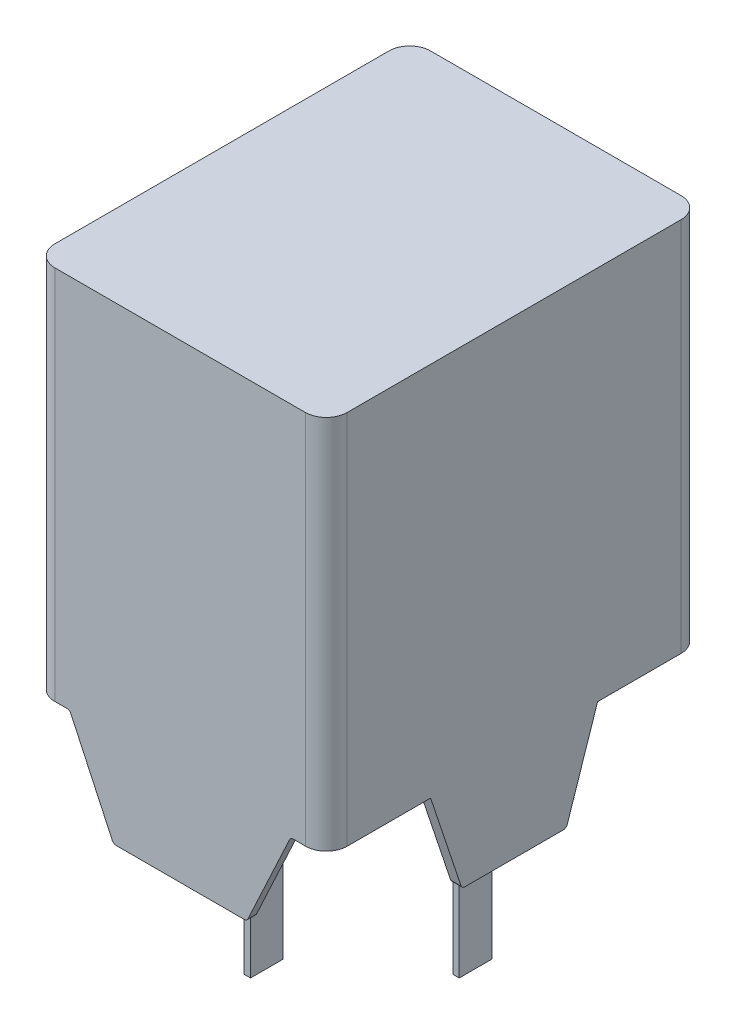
SolidWorks part; units mm, degrees
ref_plane "Plan de face" through (0, 0, 0) normal (0, 0, 1) x (1, 0, 0)
ref_plane "Plan de dessus" through (0, 0, 0) normal (0, 1, 0) x (1, 0, 0)
ref_plane "Plan de droite" through (0, 0, 0) normal (1, 0, 0) x (0, 0, -1)
sketch "Esquisse1" plane through (0, 0, 0) normal (0, 0, 1) x (1, 0, 0)
  line L1 (-7, -11.25) -> (7, -11.25)
  line L2 (-7, -11.25) -> (-7, 11.25)
  line L3 (-7, 11.25) -> (7, 11.25)
  line L4 (7, -11.25) -> (7, 11.25)
  line L5 (-7, -11.25) -> (7, 11.25) construction
  line L6 (-7, 11.25) -> (7, -11.25) construction
  point P0 (0, 0)
  dimension "D1" = 14
  dimension "D2" = 22.5
extrude "Boss.-Extru.1" add sketch "Esquisse1" along normal blind 18
sketch "Esquisse2" plane through (0, 0, 18) normal (0, 0, 1) x (1, 0, 0)
  line L0 (-7, -6.75) -> (7, -6.75) construction
  line L1 (-7, 11.25) -> (-7, -11.25) construction
  line L2 (7, -11.25) -> (7, 11.25) construction
  line L3 (-7, -11.25) -> (7, -11.25) construction
  line L4 (0, -11.25) -> (0, -6.75) construction
  line L17 (-5.4229, -6.739) -> (-7, -6.75)
  line L18 (5.4229, -6.739) -> (7, -6.75)
  line L19 (-3.0682, -11.25) -> (3.0682, -11.25)
  line L20 (-5.2401, -6.8546) -> (-3.2495, -11.1343)
  line L21 (3.2495, -11.1343) -> (5.2401, -6.8546)
  line L26 (7, -11.25) -> (7, 11.25)
  line L27 (7, 11.25) -> (-7, 11.25)
  line L28 (-7, 11.25) -> (-7, -11.25)
  line L29 (-7, -11.25) -> (7, -11.25)
  line L30 (7, -11.25) -> (7, -6.75)
  line L32 (-7, -6.75) -> (-7, -11.25)
  line L33 (-7, -11.25) -> (7, -11.25)
  arc A0 (-3.0682, -11.25) -> (-3.2495, -11.1343) centre (-3.0682, -11.05) cw
  arc A1 (3.0682, -11.25) -> (3.2495, -11.1343) centre (3.0682, -11.05) ccw
  arc A2 (5.2401, -6.8546) -> (5.4229, -6.739) centre (5.4215, -6.939) cw
  arc A3 (-5.4229, -6.739) -> (-5.2401, -6.8546) centre (-5.4215, -6.939) cw
  point P13 (0, -9)
  point P14 (0, -11.25)
  dimension "D2" = 0.2
  dimension "D1" = 4.5
  dimension "D3" = 0
extrude "Enlèv. mat.-Extru.1" cut sketch "Esquisse2" against normal blind 3 contours A3 L17 A0 L20 M3 M4 | A2 L21 A1 L18 M4 M1
sketch "Esquisse3" plane through (-7, 0, 0) normal (-1, 0, 0) x (0, 0, 1)
  line L0 (15, -11.25) -> (18, -11.25) construction
  line L1 (15, -6.75) -> (17.5866, -6.75)
  line L2 (15, -6.75) -> (15, -11.25)
  line L3 (15, -11.25) -> (17.5866, -11.25)
  line L4 (17.5866, -6.75) -> (17.5866, -11.25)
extrude "Enlèv. mat.-Extru.2" cut sketch "Esquisse3" against normal through all
sketch "Esquisse5" plane through (-7, 0, 0) normal (-1, 0, 0) x (0, 0, 1)
  line L0 (18, -6.75) -> (0, -6.75)
  line L2 (0, 11.25) -> (0, -11.25) construction
  line L3 (9, -6.75) -> (9, -11.25) construction
  line L5 (15, -11.25) -> (0, -11.25) construction
  line L6 (6.6442, -11.25) -> (11.3558, -11.25)
  line L7 (13, -6.75) -> (5, -6.75)
  line L13 (5, -6.75) -> (6.4544, -11.1132)
  line L14 (13, -6.75) -> (11.5456, -11.1132)
  arc A0 (11.3558, -11.25) -> (11.5456, -11.1132) centre (11.3558, -11.05) ccw
  arc A1 (6.6442, -11.25) -> (6.4544, -11.1132) centre (6.6442, -11.05) cw
  point P7 (9, -9)
  point P8 (9, -9)
  point P17 (9, -11.25)
  point P18 (11.5, -11.25)
  point P21 (6.5, -11.25)
  dimension "D2" = 0.2
  dimension "D1" = 5
extrude "Enlèv. mat.-Extru.3" cut sketch "Esquisse5" against normal through all contours A1 L13 L0 M12 M11 | A0 L0 L14 M12 M7
sketch "Esquisse7" plane through (0, 0, 0) normal (0, 0, -1) x (-1, 0, 0)
  line L0 (-7, -6.75) -> (7, -6.75) construction
  line L1 (-6.5, -6.75) -> (6.5, -6.75)
  line L2 (-6.5, -6.75) -> (-6.5, -11.25)
  line L3 (-6.5, -11.25) -> (6.5, -11.25)
  line L4 (6.5, -6.75) -> (6.5, -11.25)
  line L5 (-7, -11.25) -> (7, -11.25) construction
  line L6 (-7, -6.75) -> (-7, -11.1132) construction
  line L7 (7, -6.75) -> (7, -11.1132) construction
  dimension "D1" = 0.5
  dimension "D2" = 0.5
extrude "Enlèv. mat.-Extru.4" cut sketch "Esquisse7" against normal blind 17.5
fillet "Congé1" radius 1 4 edges at (7, 2.25, 0) (7, 2.25, 18) (-7, 2.25, 18) (-7, 2.25, 0)
sketch "Esquisse8" plane through (0, -6.75, 0) normal (0, -1, 0) x (1, 0, 0)
  line L0 (0, 17.5866) -> (0, 0) construction
  line L1 (5.356, 17.5866) -> (-5.356, 17.5866) construction
  line L2 (-6.5, 9) -> (6.5, 9) construction
  line L3 (-6.5, 13) -> (-6.5, 5) construction
  line L4 (6.5, 11.3558) -> (6.5, 6.6442) construction
  line L5 (-5, 9) -> (8.9376, 9) construction
  line L6 (0.15, 14.7795) -> (-0.15, 14.7795)
  line L7 (0.15, 14.7795) -> (0.15, 13.2205)
  line L8 (0.15, 13.2205) -> (-0.15, 13.2205)
  line L9 (-0.15, 14.7795) -> (-0.15, 13.2205)
  line L10 (0.15, 14.7795) -> (-0.15, 13.2205) construction
  line L11 (0.15, 13.2205) -> (-0.15, 14.7795) construction
  line L12 (-4.85, 9.7795) -> (-5.15, 9.7795)
  line L13 (-4.85, 9.7795) -> (-4.85, 8.2205)
  line L14 (-4.85, 8.2205) -> (-5.15, 8.2205)
  line L15 (-5.15, 9.7795) -> (-5.15, 8.2205)
  line L16 (-4.85, 9.7795) -> (-5.15, 8.2205) construction
  line L17 (-4.85, 8.2205) -> (-5.15, 9.7795) construction
  line L18 (5.15, 9.7795) -> (4.85, 9.7795)
  line L19 (5.15, 9.7795) -> (5.15, 8.2205)
  line L20 (5.15, 8.2205) -> (4.85, 8.2205)
  line L21 (4.85, 9.7795) -> (4.85, 8.2205)
  line L22 (5.15, 9.7795) -> (4.85, 8.2205) construction
  line L23 (5.15, 8.2205) -> (4.85, 9.7795) construction
  point P11 (0, 14)
  point P16 (-5, 9)
  point P21 (5, 9)
  point P26 (0, 0)
  point P27 (0, 0)
  dimension "D1" = 5
  dimension "D2" = 0.3
  dimension "D3" = 5
  dimension "D4" = 5
extrude "Boss.-Extru.3" add sketch "Esquisse8" along normal blind 10
